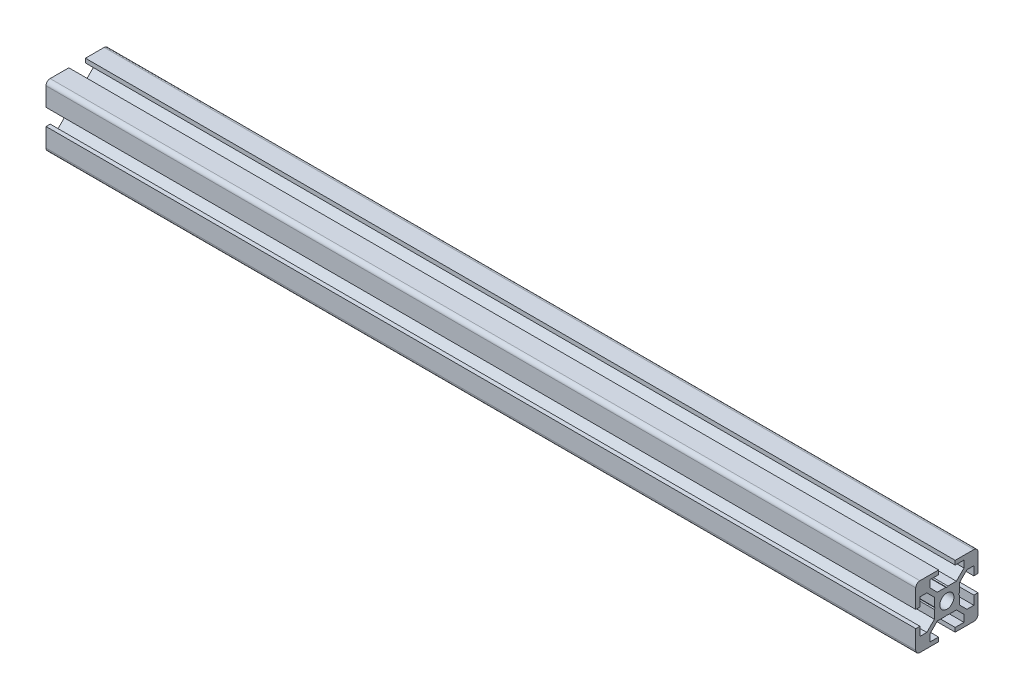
SolidWorks part; units mm, degrees
ref_plane "Front Plane" through (0, 0, 0) normal (0, 0, 1) x (1, 0, 0)
ref_plane "Top Plane" through (0, 0, 0) normal (0, 1, 0) x (1, 0, 0)
ref_plane "Right Plane" through (0, 0, 0) normal (1, 0, 0) x (0, 0, -1)
sketch "Sketch113" plane through (0, 0, 0) normal (1, 0, 0) x (0, -1, 0)
  line L0 (15, -4) -> (13, -4)
  line L1 (13, -4) -> (13, -8.25)
  line L2 (13, -8.25) -> (9.6642, -8.25)
  line L3 (9.6642, -8.25) -> (6, -4.5858)
  line L4 (6, -4.5858) -> (6, -0.5196)
  line L5 (6, -0.5196) -> (5.7, 0)
  line L6 (5.7, 0) -> (6, 0.5196)
  line L7 (6, 0.5196) -> (6, 4.5858)
  line L8 (6, 4.5858) -> (9.6642, 8.25)
  line L9 (9.6642, 8.25) -> (13, 8.25)
  line L10 (13, 8.25) -> (13, 4)
  line L11 (13, 4) -> (15, 4)
  line L12 (15, 4) -> (15, 13)
  line L13 (13, 15) -> (4, 15)
  line L14 (4, 15) -> (4, 13)
  line L15 (4, 13) -> (8.25, 13)
  line L16 (8.25, 13) -> (8.25, 9.6642)
  line L17 (8.25, 9.6642) -> (4.5858, 6)
  line L18 (4.5858, 6) -> (0.5196, 6)
  line L19 (0.5196, 6) -> (0, 5.7)
  line L20 (0, 5.7) -> (-0.5196, 6)
  line L21 (-0.5196, 6) -> (-4.5858, 6)
  line L22 (-4.5858, 6) -> (-8.25, 9.6642)
  line L23 (-8.25, 9.6642) -> (-8.25, 13)
  line L24 (-8.25, 13) -> (-4, 13)
  line L25 (-4, 13) -> (-4, 15)
  line L26 (-4, 15) -> (-13, 15)
  line L27 (-15, 13) -> (-15, 4)
  line L28 (-15, 4) -> (-13, 4)
  line L29 (-13, 4) -> (-13, 8.25)
  line L30 (-13, 8.25) -> (-9.6642, 8.25)
  line L31 (-9.6642, 8.25) -> (-6, 4.5858)
  line L32 (-6, 4.5858) -> (-6, 0.5196)
  line L33 (-6, 0.5196) -> (-5.7, 0)
  line L34 (-5.7, 0) -> (-6, -0.5196)
  line L35 (-6, -0.5196) -> (-6, -4.5858)
  line L36 (-6, -4.5858) -> (-9.6642, -8.25)
  line L37 (-9.6642, -8.25) -> (-13, -8.25)
  line L38 (-13, -8.25) -> (-13, -4)
  line L39 (-13, -4) -> (-15, -4)
  line L40 (-15, -4) -> (-15, -13)
  line L41 (-13, -15) -> (-4, -15)
  line L42 (-4, -15) -> (-4, -13)
  line L43 (-4, -13) -> (-8.25, -13)
  line L44 (-8.25, -13) -> (-8.25, -9.6642)
  line L45 (-8.25, -9.6642) -> (-4.5858, -6)
  line L46 (-4.5858, -6) -> (-0.5196, -6)
  line L47 (-0.5196, -6) -> (0, -5.7)
  line L48 (0, -5.7) -> (0.5196, -6)
  line L49 (0.5196, -6) -> (4.5858, -6)
  line L50 (4.5858, -6) -> (8.25, -9.6642)
  line L51 (8.25, -9.6642) -> (8.25, -13)
  line L52 (8.25, -13) -> (4, -13)
  line L53 (4, -13) -> (4, -15)
  line L54 (4, -15) -> (13, -15)
  line L55 (15, -13) -> (15, -4)
  circle A0 centre (0, 0) radius 3.4
  arc A1 (15, 13) -> (13, 15) centre (13, 13) ccw
  arc A2 (-13, 15) -> (-15, 13) centre (-13, 13) ccw
  arc A3 (-15, -13) -> (-13, -15) centre (-13, -13) ccw
  arc A4 (13, -15) -> (15, -13) centre (13, -13) ccw
extrude "Boss-Extrude1" add sketch "Sketch113" along normal mid plane 419.1
sketch "Sketch114" plane through (0, 0, 0) normal (0, 0, 1) x (1, 0, 0)
  circle A0 centre (0, 0) radius 3.175
  dimension "D1" = 6.35
extrude "Cut-Extrude1" cut sketch "Sketch114" against normal through all both and the other way through all
